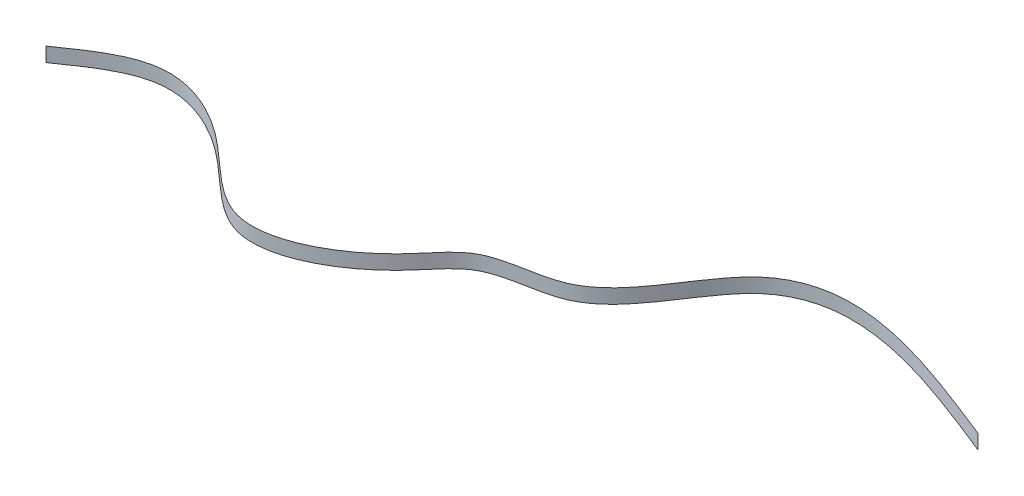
SolidWorks part; units mm, degrees
ref_plane "Y" through (0, 0, 0) normal (0, 0, 1) x (1, 0, 0)
ref_plane "Z" through (0, 0, 0) normal (0, 1, 0) x (1, 0, 0)
ref_plane "X" through (0, 0, 0) normal (1, 0, 0) x (0, 0, -1)
sketch "Skizze2" plane through (0, 0, 0) normal (0, 1, 0) x (1, 0, 0)
  point P0 (-287.0668, -9.8883)
  point P1 (273.1818, 81.3704)
surface "Oberfläche-Linear austragen1" sketch "Skizze2" parameters "D1"=10
